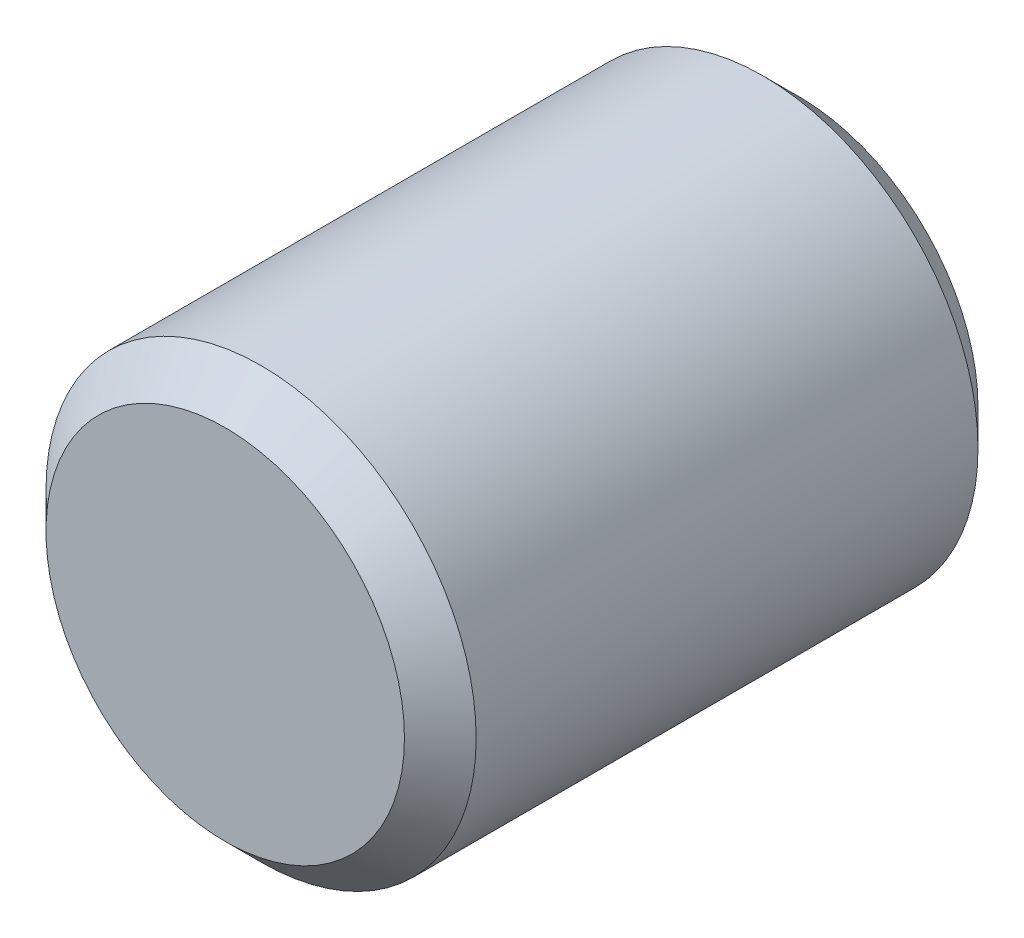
SolidWorks part; units mm, degrees
ref_plane "Plan1" through (0, 0, 0) normal (0, 0, 1) x (1, 0, 0)
ref_plane "Plan2" through (0, 0, 0) normal (0, 1, 0) x (1, 0, 0)
ref_plane "Plan3" through (0, 0, 0) normal (1, 0, 0) x (0, 0, -1)
sketch "Esquisse1" plane through (0, 0, 0) normal (0, 0, 1) x (1, 0, 0)
  circle A0 centre (0, 0) radius 6
  dimension "D1" = 12
extrude "Base-Extrusion" add sketch "Esquisse1" along normal blind 16
chamfer "Chanfrein1" distance 1 angle 45
